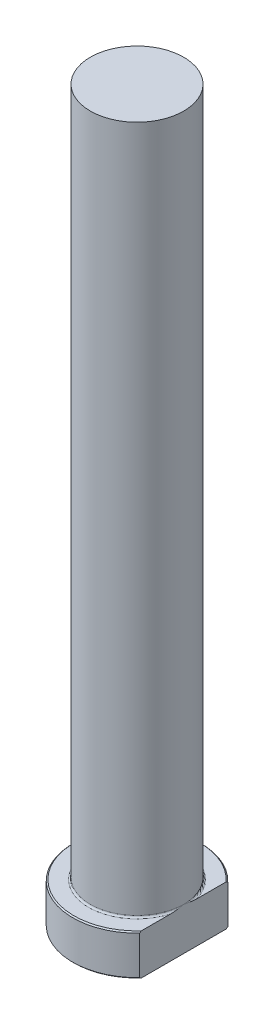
SolidWorks part; units mm, degrees
ref_plane "Front Plane" through (0, 0, 0) normal (0, 0, 1) x (1, 0, 0)
ref_plane "Top Plane" through (0, 0, 0) normal (0, 1, 0) x (1, 0, 0)
ref_plane "Right Plane" through (0, 0, 0) normal (1, 0, 0) x (0, 0, -1)
sketch "Sketch1" plane through (0, 0, 0) normal (0, 0, 1) x (1, 0, 0)
  line L0 (0, 259.9588) -> (0, -15.1925) construction
  line L1 (0, 0) -> (-11, 0)
  line L2 (-11, 0) -> (-11, 7)
  line L3 (-11, 7) -> (-8, 7)
  line L4 (-8, 7) -> (-8, 125)
  line L5 (-8, 125) -> (0, 125)
  line L6 (0, 125) -> (0, 0)
  dimension "L" = 125
  dimension "H" = 22
  dimension "T" = 7
  dimension "D" = 16
revolve "Revolve1" add sketch "Sketch1" angle 360 about L0
chamfer "Chamfer1" distance 0.2 angle 45 2 edges at (0, 7, 11) (0, 0, 11)
fillet "Fillet1" radius 0.3 1 edges at (0, 7, 8)
sketch "Sketch2" plane through (0, 0, 0) normal (0, 1, 0) x (1, 0, 0)
  line L0 (8, 7.5498) -> (8, -7.5498)
  circle A0 centre (0, 0) radius 11 construction
  arc A1 (8, -7.5498) -> (8, 7.5498) centre (0, 0) ccw
  circle A2 centre (0, 0) radius 8 construction
extrude "KEY" cut sketch "Sketch2" along normal through all
